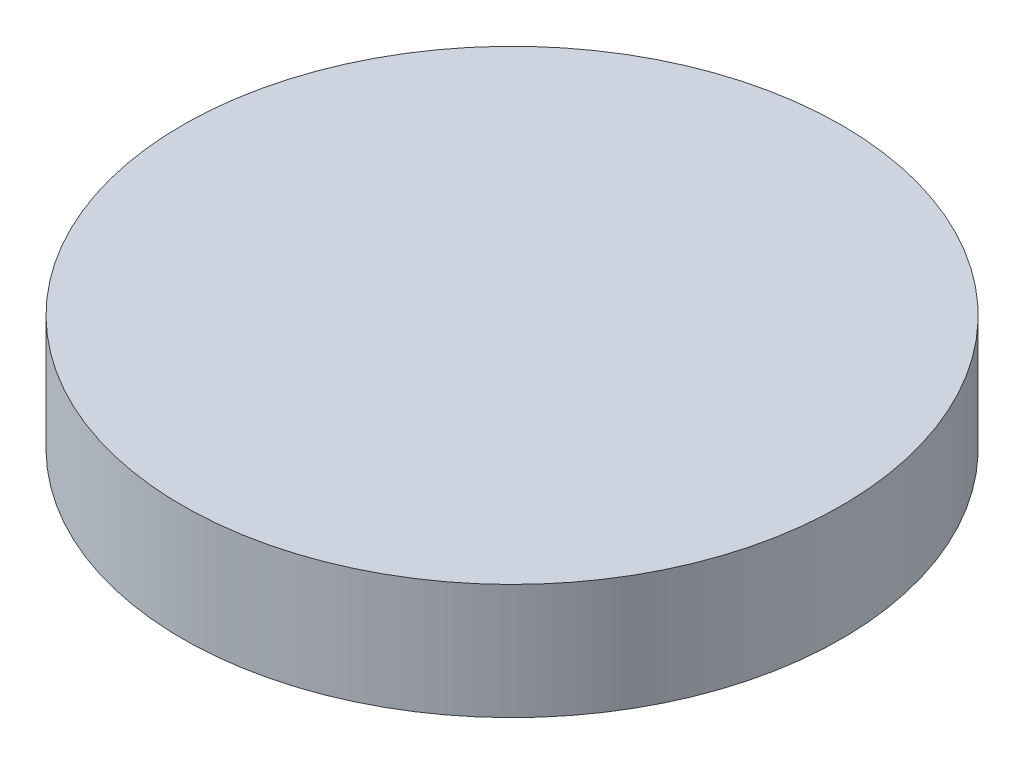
SolidWorks part; units mm, degrees
ref_plane "前视基准面" through (0, 0, 0) normal (0, 0, 1) x (1, 0, 0)
ref_plane "上视基准面" through (0, 0, 0) normal (0, 1, 0) x (1, 0, 0)
ref_plane "右视基准面" through (0, 0, 0) normal (1, 0, 0) x (0, 0, -1)
sketch "草图1" plane through (0, 0, 0) normal (0, 0, 1) x (1, 0, 0)
  line L0 (0, 0) -> (0, 587.7508) construction
  line L1 (0, 400) -> (-800, 400)
  line L2 (-800, 400) -> (-800, 120)
  line L3 (-800, 120) -> (-600, 0)
  line L4 (-600, 0) -> (0, 0)
  line L5 (0, 0) -> (0, 400)
  dimension "D1" = 1600
  dimension "D2" = 1200
  dimension "D3" = 280
  dimension "D4" = 120
revolve "旋转1" add sketch "草图1" angle 360 about L0
